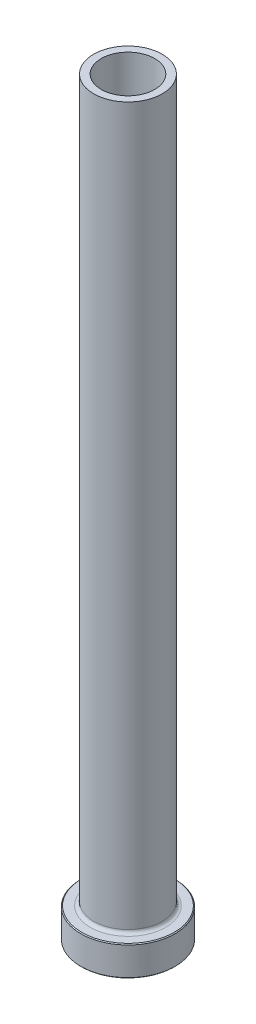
SolidWorks part; units mm, degrees
ref_plane "Front Plane" through (0, 0, 0) normal (0, 0, 1) x (1, 0, 0)
ref_plane "Top Plane" through (0, 0, 0) normal (0, 1, 0) x (1, 0, 0)
ref_plane "Right Plane" through (0, 0, 0) normal (1, 0, 0) x (0, 0, -1)
sketch "Sketch1" plane through (0, 0, 0) normal (0, 0, 1) x (1, 0, 0)
  line L0 (-6.25, 175) -> (-8, 175)
  line L1 (-8, 175) -> (-8, 7)
  line L2 (-8, 7) -> (-11, 7)
  line L3 (-11, 7) -> (-11, 0)
  line L4 (12.1, 0) -> (-12.1, 0) construction
  line L5 (-11, 0) -> (-6.5, 0)
  line L6 (-6.25, 120) -> (-6.25, 175)
  line L7 (0, 92.1877) -> (0, -15.5353) construction
  line L8 (0, -12.1) -> (0, 12.1) construction
  line L9 (-6.25, 120) -> (-6.5, 108)
  line L10 (-6.5, 108) -> (-6.5, 0)
  dimension "D1" = 0.25
  dimension "ID" = 12.5
  dimension "OD" = 16
  dimension "L" = 175
  dimension "H" = 22
  dimension "T" = 7
  dimension "N" = 55
  dimension "D2" = 12
revolve "Revolve1" add sketch "Sketch1" angle 360 about L7
fillet "Fillet1" radius 0.8 1 edges at (0, 7, 8)
chamfer "Chamfer1" distance 0.2 angle 45 2 edges at (0, 7, 11) (0, 0, 11)
chamfer "Chamfer3" distance 0.5 angle 45 1 edges at (0, 0, 6.5)
